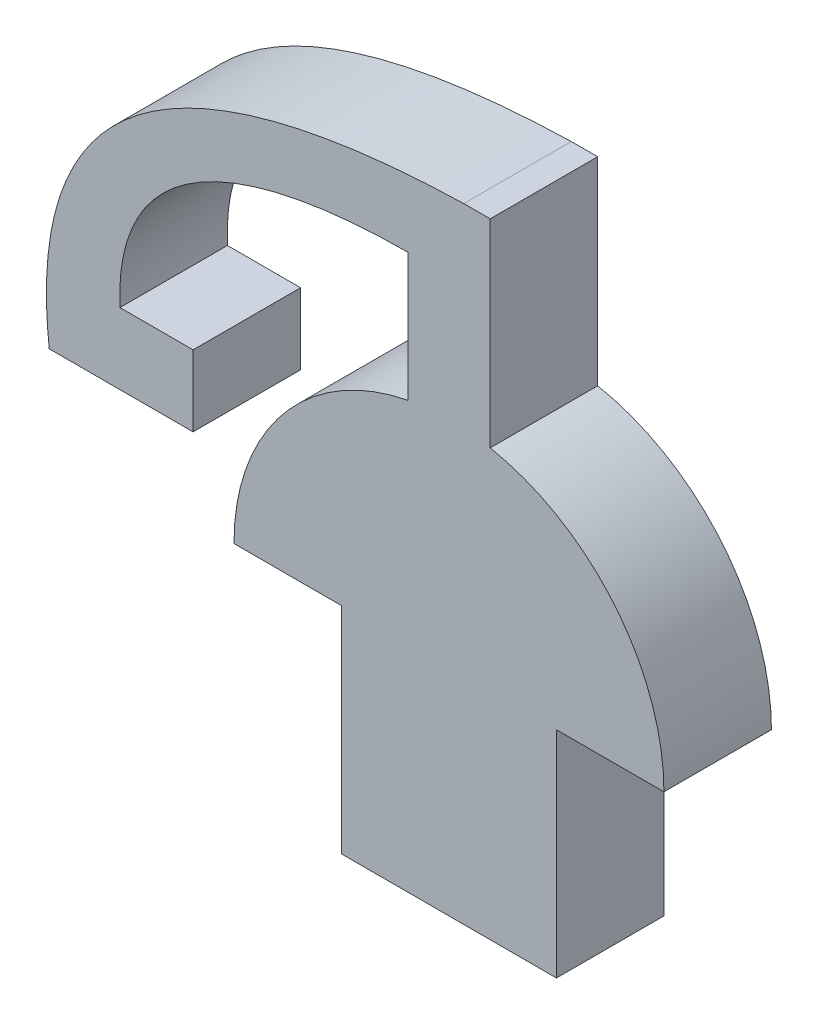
SolidWorks part; units mm, degrees
ref_plane "Front Plane" through (0, 0, 0) normal (0, 0, 1) x (1, 0, 0)
ref_plane "Top Plane" through (0, 0, 0) normal (0, 1, 0) x (1, 0, 0)
ref_plane "Right Plane" through (0, 0, 0) normal (1, 0, 0) x (0, 0, -1)
sketch "Sketch1" plane through (0, 0, 0) normal (0, 0, 1) x (1, 0, 0)
  line L0 (-11.8054, 2.2525) -> (-7.557, 2.2525)
  line L1 (0.4379, 12.0905) -> (1.2181, 12.0905)
  line L2 (-1.2125, 10.0205) -> (-1.2125, 6.2332)
  line L3 (0, -6.35) -> (3.175, -6.35)
  line L4 (1.2181, 12.0905) -> (1.2181, 6.2321)
  line L5 (-1.2494, 15.3116) -> (0.2889, 9.985) construction
  line L6 (-1.3826, 6.1977) -> (1.2181, 12.0905) construction
  line L7 (-7.557, 2.2525) -> (-7.557, 4.3524)
  line L8 (-7.557, 4.3524) -> (-9.7183, 4.3524)
  line L9 (0, -6.35) -> (-3.175, -6.35)
  line L10 (3.175, 0) -> (3.175, -6.35)
  line L11 (-6.35, 0) -> (-3.175, 0)
  line L13 (-3.175, -6.35) -> (-3.175, 0)
  line L15 (6.35, 0) -> (3.175, 0)
  arc A0 (6.35, 0) -> (1.2181, 6.2321) centre (0, 0) ccw
  arc A1 (-1.2125, 6.2332) -> (-6.35, 0) centre (0, 0) ccw
  spline S0 degree 2 poles (0.4379, 12.0905) (-12.9098, 11.7387) (-11.8054, 2.2525) knots 0 0 0 1 1 1
  spline S1 degree 3 poles (-9.7183, 4.3524) (-9.9274, 9.2319) (-4.6605, 10.0074) (-1.2125, 10.0205) knots 0 0 0 0 0.593317 0.593317 0.593317 0.593317
  point P4 (0.2889, 9.985)
extrude "Boss-Extrude1" add sketch "Sketch1" along normal blind 3.175
